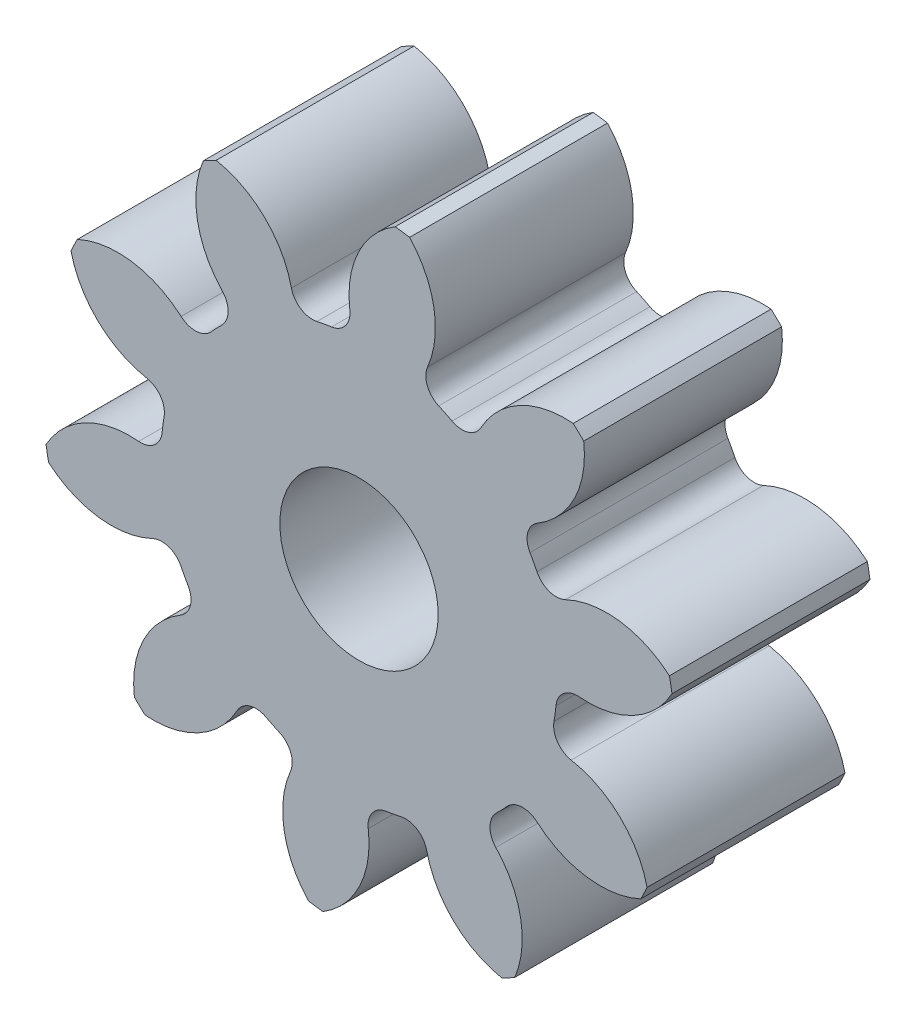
SolidWorks part; units mm, degrees
ref_plane "Front" through (0, 0, 0) normal (0, 0, 1) x (1, 0, 0)
ref_plane "Top" through (0, 0, 0) normal (0, 1, 0) x (1, 0, 0)
ref_plane "Right" through (0, 0, 0) normal (1, 0, 0) x (0, 0, -1)
sketch "Sketch3" plane through (0, 0, 0) normal (0, 0, 1) x (1, 0, 0)
  circle A0 centre (0, 0) radius 203.2
  dimension "od" = 406.4
extrude "gearBody" add sketch "Sketch3" along normal blind 127
sketch "Sketch2" plane through (0, 0, 0) normal (0, 0, 1) x (1, 0, 0)
  line L0 (0, 0) -> (147.0089, 60.8931) construction
  line L1 (185.8315, -89.7202) -> (0, 0) construction
  line L2 (0, 0) -> (36.3143, 0) construction
  line L3 (169.2951, 3.5988) -> (161.9733, -49.3804) construction
  line L5 (165.6342, -22.8908) -> (0, 0) construction
  line L7 (0, 0) -> (159.1213, 0) construction
  arc A0 (159.1201, 0.6218) -> (152.9871, -43.7553) centre (0, 0) ccw construction
  arc A1 (200.801, 31.132) -> (184.8307, -84.4266) centre (0, 0) ccw construction
  arc A2 (169.2951, 3.5988) -> (161.9733, -49.3804) centre (0, 0) ccw construction
  arc A3 (125.0665, -22.0763) -> (126.3662, -12.6719) centre (0, 0) ccw
  arc A4 (185.8315, -89.7202) -> (136.1391, -38.0272) centre (124.983, -98.4826) ccw
  arc A5 (185.8315, -89.7202) -> (203.2, 35.9557) centre (0, 0) ccw
  arc A6 (203.2, 35.9557) -> (141.35, -0.322) centre (147.0089, 60.8931) cw
  arc A7 (126.3662, -12.6719) -> (141.35, -0.322) centre (140.0812, -14.0472) cw
  arc A8 (136.1391, -38.0272) -> (125.0665, -22.0763) centre (138.6404, -24.4723) cw
  point P6 (203.2, 35.9557)
  point P22 (185.8315, -89.7202)
  dimension "baseDia" = 318.2426
  dimension "od" = 406.4
  dimension "pd" = 338.6667
  dimension "rd" = 254
  dimension "rFillet" = 13.7837
  dimension "pointX" = 203.2
  dimension "pointY" = 35.9557
  dimension "CTT" = 52.9791
  dimension "flankCenterAngle" = 22.5
extrude "toothCut" cut sketch "Sketch2" along normal through all
pattern_circular "CirPattern1" count 10 over 360 about axis through (0, 0, 0) along (0, 0, 1) of "toothCut"
sketch "hub1Dia" plane through (0, 0, 0) normal (0, 0, -1) x (-1, 0, 0)
  circle A0 centre (0, 0) radius 12.7
  dimension "hub1Dia" = 25.4
sketch "hub2Dia" plane through (0, 0, 127) normal (0, 0, 1) x (1, 0, 0)
  circle A0 centre (0, 0) radius 12.7
  dimension "hub2dia" = 25.4
sketch "boreDia" plane through (0, 0, 0) normal (0, 0, 1) x (1, 0, 0)
  circle A0 centre (0, 0) radius 50.8
  dimension "boreDia" = 101.6
extrude "bore" cut sketch "boreDia" against normal mid plane 25400
